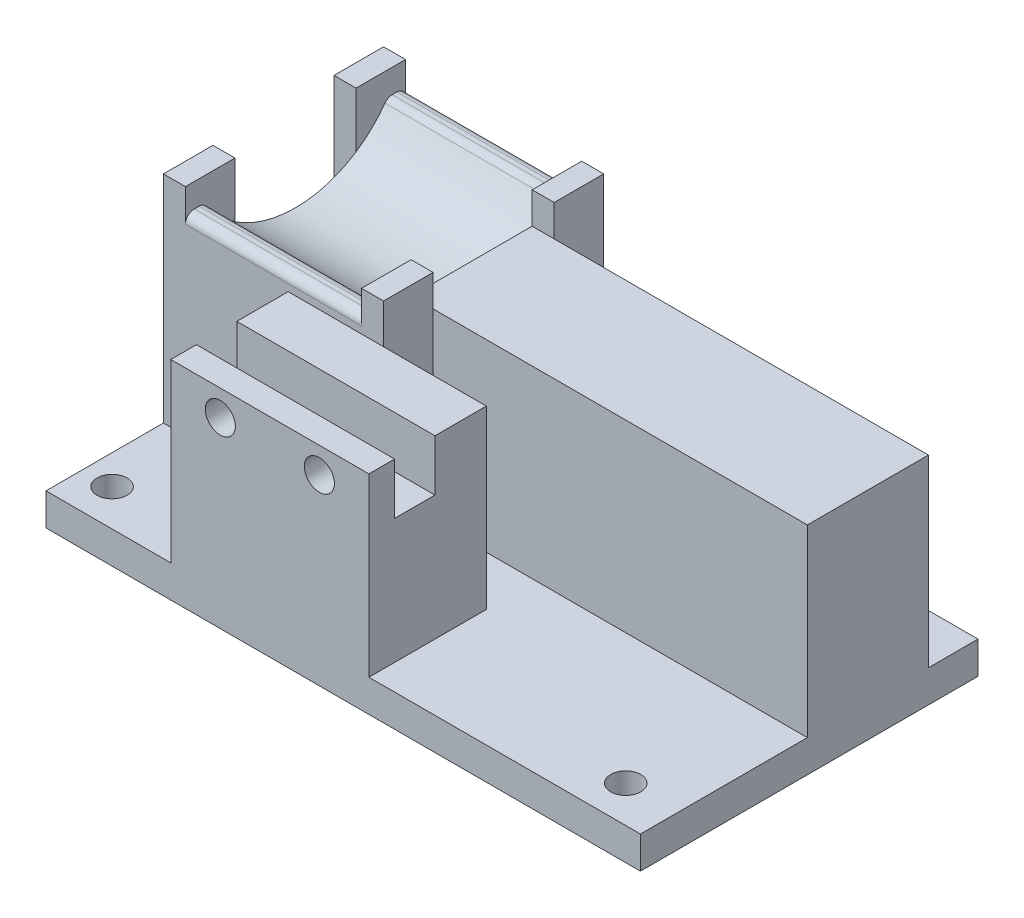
SolidWorks part; units mm, degrees
ref_plane "Front Plane" through (0, 0, 0) normal (0, 0, 1) x (1, 0, 0)
ref_plane "Top Plane" through (0, 0, 0) normal (0, 1, 0) x (1, 0, 0)
ref_plane "Right Plane" through (0, 0, 0) normal (1, 0, 0) x (0, 0, -1)
sketch "Sketch1" plane through (0, 0, 0) normal (0, 1, 0) x (1, 0, 0)
  line L1 (40.5, -23) -> (-40.5, -23)
  line L2 (40.5, -23) -> (40.5, 23)
  line L3 (40.5, 23) -> (-40.5, 23)
  line L4 (-40.5, -23) -> (-40.5, 23)
  line L5 (40.5, -23) -> (-40.5, 23) construction
  line L6 (40.5, 23) -> (-40.5, -23) construction
  point P0 (0, 0)
  dimension "D1" = 81
  dimension "D2" = 46
extrude "Boss-Extrude1" add sketch "Sketch1" along normal blind 4.39
sketch "Sketch3" plane through (0, 4.39, 0) normal (0, 1, 0) x (1, 0, 0)
  line L1 (-40.5, 23) -> (-10.5, 23)
  line L2 (-40.5, 23) -> (-40.5, -7)
  line L3 (-40.5, -7) -> (-10.5, -7)
  line L4 (-10.5, 23) -> (-10.5, -7)
  dimension "D1" = 30
  dimension "D2" = 30
extrude "Boss-Extrude2" add sketch "Sketch3" along normal blind 34.4
ref_plane "Plane3" through (-13.5, 0, 0) normal (1, 0, 0) x (0, 0, -1)
sketch "Sketch7" plane through (-13.5, 0, 0) normal (1, 0, 0) x (0, 0, -1)
  line L0 (-7, 38.79) -> (23, 38.79) construction
  line L1 (-7, 38.79) -> (23, 38.79)
  arc A0 (-7, 38.79) -> (23, 38.79) centre (8, 38.79) ccw
  dimension "D1" = 15
extrude "Cut-Extrude2" cut sketch "Sketch7" against normal blind 24
sketch "Sketch9" plane through (0, 0, 7) normal (0, 0, 1) x (1, 0, 0)
  line L0 (-40.5, 38.79) -> (-37.5, 38.79) construction
  line L1 (-37.5, 38.79) -> (-13.5, 38.79)
  line L2 (-37.5, 38.79) -> (-37.5, 30.5469)
  line L3 (-37.5, 30.5469) -> (-13.5, 30.5469)
  line L4 (-13.5, 38.79) -> (-13.5, 30.5469)
  line L5 (-40.5, 38.79) -> (-40.5, 4.39) construction
  line L6 (-10.5, 38.79) -> (-10.5, 4.39) construction
  dimension "D1" = 3
  dimension "D2" = 3
extrude "Cut-Extrude3" cut sketch "Sketch9" against normal up to surface (30 mm away)
sketch "Sketch11" plane through (-10.5, 0, 0) normal (1, 0, 0) x (0, 0, -1)
  line L0 (8, 38.79) -> (8, 4.39) construction
  line L1 (-7, 38.79) -> (23, 38.79) construction
  line L2 (-7, 4.39) -> (23, 4.39) construction
  line L3 (8, 38.79) -> (-0.25, 38.79) construction
  line L4 (8, 38.79) -> (16.25, 38.79) construction
  line L6 (-0.25, 38.79) -> (16.25, 38.79)
  line L7 (-0.25, 38.79) -> (-0.25, 4.39)
  line L8 (-0.25, 4.39) -> (16.25, 4.39)
  line L9 (16.25, 38.79) -> (16.25, 4.39)
  dimension "D1" = 8.25
  dimension "D2" = 8.25
extrude "Cut-Extrude4" cut sketch "Sketch11" against normal blind 3
ref_plane "Plane4" through (-25.5, 0, 0) normal (1, 0, 0) x (0, 0, -1)
sketch "Sketch18" plane through (0, 38.79, 0) normal (0, 1, 0) x (1, 0, 0)
  line L1 (-13.5, -7) -> (-10.5, -7)
  line L2 (-13.5, -7) -> (-13.5, -0.25)
  line L3 (-13.5, -0.25) -> (-10.5, -0.25)
  line L4 (-10.5, -7) -> (-10.5, -0.25)
  line L5 (-10.5, 16.25) -> (-13.5, 16.25)
  line L6 (-10.5, 16.25) -> (-10.5, 23)
  line L7 (-10.5, 23) -> (-13.5, 23)
  line L8 (-13.5, 16.25) -> (-13.5, 23)
extrude "Cut-Extrude8" cut sketch "Sketch18" against normal blind 5
mirror "Mirror3" about plane through (-25.5, 0, 0) normal (1, 0, 0) of "Cut-Extrude8", "Cut-Extrude4"
sketch "Sketch12" plane through (0, 4.39, 0) normal (0, 1, 0) x (1, 0, 0)
  line L0 (-40.5, -7) -> (-23.5, -7) construction
  line L1 (-40.5, -7) -> (-10.5, -7) construction
  line L2 (-40.5, -23) -> (40.5, -23) construction
  line L3 (-23.5, -7) -> (3.5, -7)
  line L4 (-23.5, -7) -> (-23.5, -23)
  line L5 (-23.5, -23) -> (3.5, -23)
  line L6 (3.5, -7) -> (3.5, -23)
  dimension "D1" = 17
  dimension "D2" = 27
extrude "Boss-Extrude3" add sketch "Sketch12" along normal blind 24
sketch "Sketch13" plane through (0, 28.39, 0) normal (0, 1, 0) x (1, 0, 0)
  line L0 (-23.5, -7) -> (-23.5, -23) construction
  line L1 (-23.5, -14) -> (3.5, -14)
  line L2 (-23.5, -14) -> (-23.5, -19.5)
  line L3 (-23.5, -19.5) -> (3.5, -19.5)
  line L4 (3.5, -14) -> (3.5, -19.5)
  line L5 (3.5, -23) -> (3.5, -7) construction
  line L6 (-23.5, -23) -> (3.5, -23) construction
  dimension "D1" = 3.5
  dimension "D2" = 5.5
extrude "Cut-Extrude5" cut sketch "Sketch13" against normal blind 7
sketch "Sketch14" plane through (0, 0, 23) normal (0, 0, 1) x (1, 0, 0)
  line L0 (-16.75, 24.89) -> (-10, 24.89) construction
  line L1 (-23.5, 28.39) -> (3.5, 28.39) construction
  line L2 (-10, 24.89) -> (-3.25, 24.89) construction
  line L3 (-10, 24.89) -> (-10, 24.3411) construction
  line L5 (-16.75, 24.89) -> (-23.5, 24.89) construction
  line L6 (-23.5, 28.39) -> (-23.5, 4.39) construction
  circle A0 centre (-16.75, 24.89) radius 2.05
  circle A1 centre (-3.25, 24.89) radius 2.05
  dimension "D1" = 4.1
  dimension "D5" = 4.1
  dimension "D2" = 6.75
  dimension "D3" = 3.5
  dimension "D4" = 6.75
extrude "Cut-Extrude6" cut sketch "Sketch14" against normal up to surface (3.5 mm away)
sketch "Sketch15" plane through (0, 4.39, 0) normal (0, 1, 0) x (1, 0, 0)
  line L0 (-40.5, -18) -> (-36.5, -18) construction
  line L1 (-40.5, -7) -> (-40.5, -23) construction
  line L2 (-40.5, -23) -> (-23.5, -23) construction
  line L3 (-36.5, -18) -> (33.5, -18) construction
  circle A0 centre (-36.5, -18) radius 2.05
  circle A1 centre (33.5, -18) radius 2.05
  dimension "D3" = 4.1
  dimension "D5" = 4.1
  dimension "D1" = 5
  dimension "D2" = 4
  dimension "D4" = 70
extrude "Cut-Extrude7" cut sketch "Sketch15" against normal up to next
sketch "Sketch17" plane through (0, 4.39, 0) normal (0, 1, 0) x (1, 0, 0)
  line L0 (40.5, -23) -> (40.5, 23) construction
  line L1 (-13.5, -0.25) -> (40.5, -0.25)
  line L2 (-13.5, -0.25) -> (-13.5, 16.25)
  line L3 (-13.5, 16.25) -> (40.5, 16.25)
  line L4 (40.5, -0.25) -> (40.5, 16.25)
  line L5 (-13.5, 16.25) -> (-10.5, 16.25) construction
extrude "Boss-Extrude4" add sketch "Sketch17" along normal blind 25.1
fillet "Fillet1" radius 1.2 2 edges at (-25.5, 30.5469, -23) (-25.5, 30.5469, -20.532)
fillet "Fillet2" radius 1.2 2 edges at (-25.5, 30.5469, 7) (-25.5, 30.5469, 4.532)
